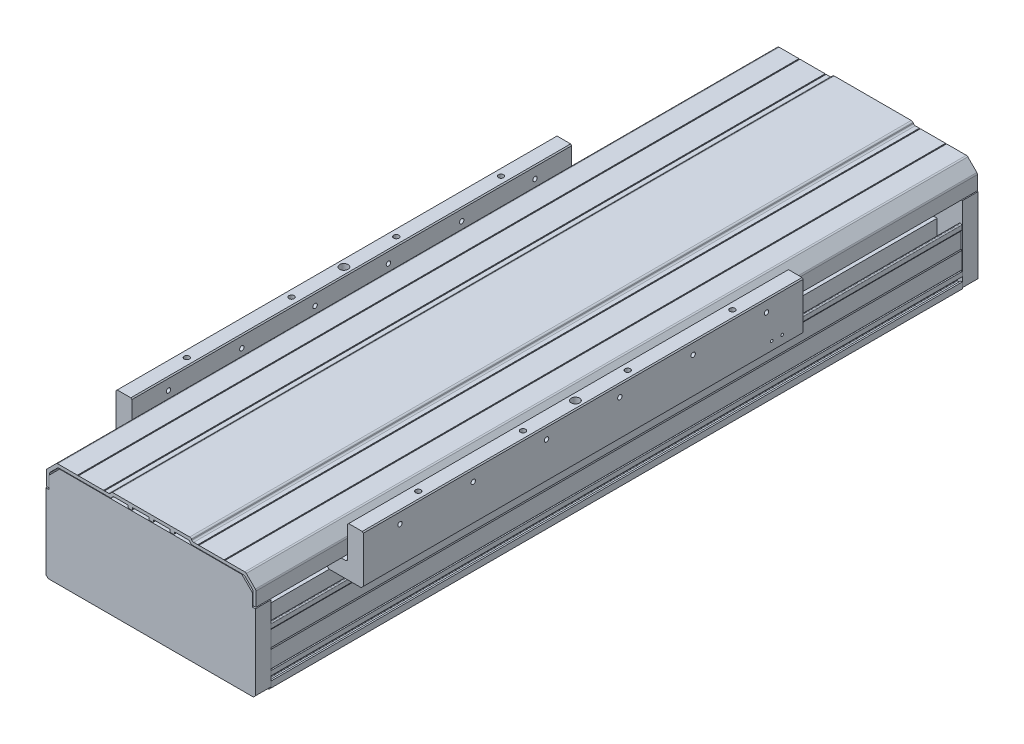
SolidWorks part; units mm, degrees
ref_plane "정면" through (0, 0, 0) normal (0, 0, 1) x (1, 0, 0)
ref_plane "윗면" through (0, 0, 0) normal (0, 1, 0) x (1, 0, 0)
ref_plane "우측면" through (0, 0, 0) normal (1, 0, 0) x (0, 0, -1)
sketch "스케치1" plane through (0, 0, 0) normal (0, 0, 1) x (1, 0, 0)
  line L0 (-99, 33.5) -> (-99, 48.5)
  line L1 (-97, 16.5) -> (-97, 53.5)
  line L2 (-99.5, 16.5) -> (-99.5, 32.5)
  line L3 (-97.5, 16) -> (-99, 16)
  line L4 (-99, 33.5) -> (-99.5, 32.5)
  line L5 (-98.5, 54.5) -> (-98, 54.5)
  line L6 (-99.5, 49.5) -> (-99.5, 53.5)
  line L7 (-99, 48.5) -> (-99.5, 49.5)
  line L8 (99, 33.5) -> (99, 48.5)
  line L9 (97, 16.5) -> (97, 53.5)
  line L10 (99.5, 16.5) -> (99.5, 32.5)
  line L11 (97.5, 16) -> (99, 16)
  line L12 (99, 33.5) -> (99.5, 32.5)
  line L13 (98.5, 54.5) -> (98, 54.5)
  line L14 (99.5, 49.5) -> (99.5, 53.5)
  line L15 (99, 48.5) -> (99.5, 49.5)
  line L16 (-78, 44.5) -> (-43.5, 44.5)
  line L17 (-36, -1) -> (-98, -1)
  line L18 (-66.55, 32.5) -> (-54.5, 32.5)
  line L19 (-100, 1) -> (-98, -1)
  line L20 (-78, 44.5) -> (-78, 37.5)
  line L21 (-69.5, 14.5) -> (-69.5, 30.0927)
  line L22 (-77.7, 37) -> (-78, 36.5)
  line L23 (-78, 37.5) -> (-77.7, 37)
  line L24 (-78, 26.5) -> (-77.1807, 25.0809)
  line L25 (-78, 36.5) -> (-78, 26.5)
  line L26 (-97, 21) -> (-97, 15.5)
  line L27 (-97, 25.5) -> (-97, 22)
  line L28 (-97, 15.5) -> (-100, 15.5)
  line L29 (36, -1) -> (98, -1)
  line L30 (35, 0) -> (-35, 0)
  line L31 (-35, 0) -> (-36, -1)
  line L32 (36, -1) -> (35, 0)
  line L33 (100, 1) -> (98, -1)
  line L34 (-16.9019, 9.5) -> (-14.3038, 11)
  line L35 (-14.3038, 5) -> (-16.9019, 6.5)
  line L36 (-22.5, 16) -> (22.5, 16)
  line L37 (-23, 16.5) -> (-22.5, 16)
  line L38 (-16.9019, 9.5) -> (-18.0629, 9.5)
  line L39 (-16.9019, 6.5) -> (-18.0629, 6.5)
  line L40 (-52.5, 30.5) -> (-52.5, 16.25)
  line L41 (-52, 15.75) -> (-51.4079, 15.75)
  line L42 (-51.6685, 12.5) -> (-67.5, 12.5)
  line L43 (-38.5, 16.5) -> (-23, 16.5)
  line L44 (22.5, 16) -> (23, 16.5)
  line L45 (23, 16.5) -> (38.5, 16.5)
  line L46 (16.9019, 9.5) -> (14.3038, 11)
  line L47 (14.3038, 5) -> (16.9019, 6.5)
  line L48 (16.9019, 9.5) -> (18.0629, 9.5)
  line L49 (16.9019, 6.5) -> (18.0629, 6.5)
  line L50 (-4, 9) -> (4, 9)
  line L51 (-7.3333, 11) -> (-4, 9)
  line L52 (7.3333, 11) -> (4, 9)
  line L53 (-14.3038, 11) -> (-7.3333, 11)
  line L54 (-14.3038, 5) -> (14.3038, 5)
  line L55 (7.3333, 11) -> (14.3038, 11)
  line L56 (43.5, 22.5) -> (43.5, 44.5)
  line L57 (97, 21) -> (97, 15.5)
  line L58 (97, 15.5) -> (100, 15.5)
  line L59 (97, 25.5) -> (97, 22)
  line L60 (95, 25.5) -> (97, 25.5)
  line L61 (95, 24) -> (95, 25.5)
  line L62 (71, 47.5) -> (71, 44.5)
  line L63 (71, 47.5) -> (76, 47.5)
  line L64 (71, 44.5) -> (43.5, 44.5)
  line L65 (100, 1) -> (100, 6.85)
  line L66 (98.5, 11.15) -> (100, 11.15)
  line L67 (98.5, 12.65) -> (98.5, 11.15)
  line L68 (95.5, 12.65) -> (98.5, 12.65)
  line L69 (95, 5.85) -> (95, 12.15)
  line L70 (98.5, 5.35) -> (95.5, 5.35)
  line L71 (98.5, 6.85) -> (98.5, 5.35)
  line L72 (100, 6.85) -> (98.5, 6.85)
  line L73 (100, 11.15) -> (100, 15.5)
  line L74 (-100, 1) -> (-100, 6.85)
  line L75 (-98.5, 11.15) -> (-100, 11.15)
  line L76 (-98.5, 12.65) -> (-98.5, 11.15)
  line L77 (-95.5, 12.65) -> (-98.5, 12.65)
  line L78 (-95, 5.85) -> (-95, 12.15)
  line L79 (-98.5, 5.35) -> (-95.5, 5.35)
  line L80 (-98.5, 6.85) -> (-98.5, 5.35)
  line L81 (-100, 6.85) -> (-98.5, 6.85)
  line L82 (-100, 11.15) -> (-100, 15.5)
  line L83 (38.5, 17.5) -> (38.5, 16.5)
  line L84 (-43.5, 22.5) -> (-43.5, 44.5)
  line L85 (-38.5, 17.5) -> (-38.5, 16.5)
  line L86 (80.8, 21) -> (79.5, 21)
  line L87 (79.5, 18) -> (93.5, 18)
  line L88 (79.5, 21) -> (79.5, 18)
  line L89 (92, 21.2) -> (92, 22.8)
  line L90 (92.2, 21) -> (92, 21.2)
  line L91 (93.5, 21) -> (92.2, 21)
  line L92 (92.2, 23) -> (94, 23)
  line L93 (92, 22.8) -> (92.2, 23)
  line L94 (93.5, 18) -> (93.5, 21)
  line L95 (81, 22.8) -> (81, 21.2)
  line L96 (81, 21.2) -> (80.8, 21)
  line L97 (80.8, 23) -> (81, 22.8)
  line L98 (78.4, 23) -> (80.8, 23)
  line L99 (-95, 25.5) -> (-97, 25.5)
  line L100 (-95, 24) -> (-95, 25.5)
  line L101 (-80.8, 21) -> (-79.5, 21)
  line L102 (-79.5, 18) -> (-93.5, 18)
  line L103 (-79.5, 21) -> (-79.5, 18)
  line L104 (-92, 21.2) -> (-92, 22.8)
  line L105 (-92.2, 21) -> (-92, 21.2)
  line L106 (-93.5, 21) -> (-92.2, 21)
  line L107 (-92.2, 23) -> (-94, 23)
  line L108 (-92, 22.8) -> (-92.2, 23)
  line L109 (-93.5, 18) -> (-93.5, 21)
  line L110 (-81, 22.8) -> (-81, 21.2)
  line L111 (-81, 21.2) -> (-80.8, 21)
  line L112 (-80.8, 23) -> (-81, 22.8)
  line L113 (-78.4, 23) -> (-80.8, 23)
  line L114 (76, 47.5) -> (76, 31.4999)
  line L115 (76, 31.4999) -> (76.3, 31.4999)
  line L116 (76.3, 31.4999) -> (76.3, 24.581)
  line L117 (-97, 22) -> (-96.7, 21.5)
  line L118 (-96.7, 21.5) -> (-97, 21)
  line L119 (97, 22) -> (96.7, 21.5)
  line L120 (96.7, 21.5) -> (97, 21)
  line L121 (66.55, 32.5) -> (54.5, 32.5)
  line L122 (69.5, 14.5) -> (69.5, 30.0927)
  line L123 (52.5, 30.5) -> (52.5, 16.25)
  line L124 (52, 15.75) -> (51.4079, 15.75)
  line L125 (51.6685, 12.5) -> (67.5, 12.5)
  arc A0 (-99.5, 16.5) -> (-99, 16) centre (-99, 16.5) ccw
  arc A1 (-97.5, 16) -> (-97, 16.5) centre (-97.5, 16.5) ccw
  arc A2 (-98.5, 54.5) -> (-99.5, 53.5) centre (-98.5, 53.5) ccw
  arc A3 (-97, 53.5) -> (-98, 54.5) centre (-98, 53.5) ccw
  arc A4 (99, 16) -> (99.5, 16.5) centre (99, 16.5) ccw
  arc A5 (97, 16.5) -> (97.5, 16) centre (97.5, 16.5) ccw
  arc A6 (99.5, 53.5) -> (98.5, 54.5) centre (98.5, 53.5) ccw
  arc A7 (98, 54.5) -> (97, 53.5) centre (98, 53.5) ccw
  arc A8 (-69.5, 14.5) -> (-67.5, 12.5) centre (-67.5, 14.5) ccw
  arc A9 (-77.4769, 22.3846) -> (-76.1936, 24.5882) centre (-76, 23) ccw
  arc A10 (-77.4769, 22.3846) -> (-78.4, 23) centre (-78.4, 22) ccw
  arc A11 (-67.05, 33) -> (-66.55, 32.5) centre (-66.55, 33) ccw
  arc A12 (-77.1807, 25.0809) -> (-76.1936, 24.5882) centre (-76.3147, 25.5809) ccw
  arc A13 (-69.5, 30.0927) -> (-69.9153, 30.5854) centre (-70, 30.0927) ccw
  arc A14 (-18.0629, 9.5) -> (-18.0629, 6.5) centre (-20, 8) ccw
  arc A15 (-52.5, 16.25) -> (-52, 15.75) centre (-52, 16.25) ccw
  arc A16 (-51.4079, 15.75) -> (-51.0845, 15.8686) centre (-51.4079, 16.25) ccw
  arc A17 (-51.301, 12.339) -> (-51.0845, 15.8686) centre (-49.5, 14) ccw
  arc A18 (-51.301, 12.339) -> (-51.6685, 12.5) centre (-51.6685, 12) ccw
  arc A19 (-52.5, 30.5) -> (-54.5, 32.5) centre (-54.5, 30.5) ccw
  arc A20 (18.0629, 6.5) -> (18.0629, 9.5) centre (20, 8) ccw
  arc A21 (38.5, 17.5) -> (43.5, 22.5) centre (38.5, 22.5) ccw
  arc A22 (78.4, 23) -> (77.4769, 22.3846) centre (78.4, 22) ccw
  arc A23 (94, 23) -> (95, 24) centre (94, 24) ccw
  arc A24 (95.5, 12.65) -> (95, 12.15) centre (95.5, 12.15) ccw
  arc A25 (95, 5.85) -> (95.5, 5.35) centre (95.5, 5.85) ccw
  arc A26 (-95, 12.15) -> (-95.5, 12.65) centre (-95.5, 12.15) ccw
  arc A27 (-95.5, 5.35) -> (-95, 5.85) centre (-95.5, 5.85) ccw
  arc A28 (-43.5, 22.5) -> (-38.5, 17.5) centre (-38.5, 22.5) ccw
  arc A29 (-67.05, 33) -> (-69.9153, 30.5854) centre (-69.5, 33) ccw
  arc A30 (-95, 24) -> (-94, 23) centre (-94, 24) ccw
  arc A31 (76.1936, 24.5882) -> (77.4769, 22.3846) centre (76, 23) ccw
  arc A32 (76.1936, 24.5882) -> (76.3, 24.581) centre (76.3147, 25.5809) ccw
  arc A33 (67.5, 12.5) -> (69.5, 14.5) centre (67.5, 14.5) ccw
  arc A34 (66.55, 32.5) -> (67.05, 33) centre (66.55, 33) ccw
  arc A35 (69.9153, 30.5854) -> (69.5, 30.0927) centre (70, 30.0927) ccw
  arc A36 (52, 15.75) -> (52.5, 16.25) centre (52, 16.25) ccw
  arc A37 (51.0845, 15.8686) -> (51.4079, 15.75) centre (51.4079, 16.25) ccw
  arc A38 (51.0845, 15.8686) -> (51.301, 12.339) centre (49.5, 14) ccw
  arc A39 (51.6685, 12.5) -> (51.301, 12.339) centre (51.6685, 12) ccw
  arc A40 (54.5, 32.5) -> (52.5, 30.5) centre (54.5, 30.5) ccw
  arc A41 (69.9153, 30.5854) -> (67.05, 33) centre (69.5, 33) ccw
extrude "보스-돌출1" add sketch "스케치1" along normal mid plane 660 contours A31 A32 L116 L115 L114 L63 L62 L64 L56 A21 L83 L45 L44 L36 L37 L43 L85 A28 L84 L16 L20 L23 L22 L25 L24 A12 A9 A10 L113 L112 L110 L111 L101 L103 L102 L109 L106 L105 L104 L108 L107 A30 L100 L99 L1 L117 L118 L26 L28 L82 | L9 A7 L13 A6 L14 L15 L8 L12 L10 A4 L11 A5
sketch "스케치2" plane through (0, 0, 330) normal (0, 0, 1) x (1, 0, 0)
  line L0 (97, 86) -> (87, 96)
  line L1 (-98, 0) -> (98, 0)
  line L2 (-87, 96) -> (87, 96)
  line L3 (-100, 74) -> (-100, 2)
  line L4 (-100, 2) -> (-98, 0)
  line L5 (-97, 86) -> (-87, 96)
  line L6 (-97, 86) -> (-97, 74)
  line L7 (-100, 74) -> (-97, 74)
  line L8 (100, 74) -> (100, 2)
  line L9 (100, 2) -> (98, 0)
  line L10 (97, 86) -> (97, 74)
  line L11 (97, 74) -> (100, 74)
extrude "보스-돌출2" add sketch "스케치2" along normal blind 15 separate body
sketch "스케치3" plane through (0, 0, -330) normal (0, 0, -1) x (-1, 0, 0)
  line L0 (97, 86) -> (87, 96)
  line L1 (-98, 0) -> (98, 0)
  line L2 (-87, 96) -> (87, 96)
  line L3 (-100, 74) -> (-100, 2)
  line L4 (-100, 2) -> (-98, 0)
  line L5 (-97, 86) -> (-87, 96)
  line L6 (-97, 86) -> (-97, 74)
  line L7 (-100, 74) -> (-97, 74)
  line L8 (100, 74) -> (100, 2)
  line L9 (100, 2) -> (98, 0)
  line L10 (97, 86) -> (97, 74)
  line L11 (97, 74) -> (100, 74)
extrude "보스-돌출3" add sketch "스케치3" along normal blind 15 separate body
ref_plane "평면1" through (0, 0, 260) normal (0, 0, 1) x (1, 0, 0)
sketch "스케치4" plane through (0, 0, 260) normal (0, 0, 1) x (1, 0, 0)
  line L0 (0, 0) -> (0, 72.5) construction
  line L1 (35, 0) -> (-35, 0) construction
  line L2 (104, 104) -> (103, 103)
  line L3 (103, 103) -> (103, 74)
  line L4 (101, 72) -> (96, 72)
  line L5 (94, 74) -> (94, 77.5)
  line L6 (84, 87.5) -> (58.5, 87.5)
  line L7 (58.5, 87.5) -> (56.5, 89.5)
  line L8 (56.5, 89.5) -> (-56.5, 89.5)
  line L9 (-56.5, 89.5) -> (-58.5, 87.5)
  line L10 (-58.5, 87.5) -> (-84, 87.5)
  line L11 (-94, 77.5) -> (-94, 74)
  line L12 (-96, 72) -> (-101, 72)
  line L13 (-103, 74) -> (-103, 103)
  line L14 (-103, 103) -> (-104, 104)
  line L15 (83, 72.5) -> (-83, 72.5)
  line L16 (-118, 59) -> (-118, 103)
  line L17 (-118, 59) -> (-118, 103)
  line L18 (-116, 57) -> (-85, 57)
  line L19 (-118, 59) -> (-116, 57)
  line L20 (-85, 57) -> (-83, 59)
  line L21 (-83, 59) -> (-83, 72.5)
  line L22 (-117, 104) -> (-104, 104)
  line L23 (-117, 104) -> (-118, 103)
  line L26 (83, 72.5) -> (83, 59)
  line L27 (84, 87.5) -> (58.5, 87.5)
  line L28 (118, 59) -> (118, 103)
  line L29 (85, 57) -> (116, 57)
  line L30 (116, 57) -> (118, 59)
  line L31 (117, 104) -> (104, 104)
  line L32 (118, 103) -> (117, 104)
  line L33 (81.75, 87.5) -> (84, 87.5)
  line L34 (83, 59) -> (85, 57)
  arc A0 (101, 72) -> (103, 74) centre (101, 74) ccw
  arc A1 (94, 74) -> (96, 72) centre (96, 74) ccw
  arc A2 (94, 77.5) -> (84, 87.5) centre (84, 77.5) ccw
  arc A3 (-84, 87.5) -> (-94, 77.5) centre (-84, 77.5) ccw
  arc A4 (-96, 72) -> (-94, 74) centre (-96, 74) ccw
  arc A5 (-103, 74) -> (-101, 72) centre (-101, 74) ccw
  dimension "D1" = 72.5
extrude "보스-돌출4" add sketch "스케치4" against normal blind 420 separate body contours A5 L13 L14 L22 L23 L16 L19 L18 L20 L21 L15 L26 L34 L29 L30 L28 L32 L31 L2 L3 A0 L4 A1 L5 A2 L6 L27 L7 L8 L9 L10 A3 L11 A4 L12
sketch "스케치5" plane through (0, 0, 0) normal (0, 0, 1) x (1, 0, 0)
  line L0 (0, 0) -> (0, 101.5) construction
  line L1 (-98, 0) -> (98, 0) construction
  line L2 (36.7494, 101.5) -> (-36.7494, 101.5)
  line L3 (-45.5, 99) -> (-69.5, 99)
  line L4 (-88.1265, 96) -> (-39.2151, 96)
  line L5 (-90.7833, 98.4142) -> (-99.4142, 89.7833)
  line L6 (-96.4142, 88.5407) -> (-89.5407, 95.4142)
  line L7 (-100, 75) -> (-97, 75)
  line L8 (-97, 75) -> (-97, 87.1265)
  line L9 (-100, 88.3691) -> (-100, 75)
  line L10 (-70.5, 99) -> (-89.3691, 99)
  line L11 (-70, 98.7) -> (-70.5, 99)
  line L12 (-69.5, 99) -> (-70, 98.7)
  line L13 (-37.518, 96.9417) -> (-37.1335, 97.5583)
  line L14 (-40.528, 99) -> (-44.5, 99)
  line L15 (-45, 98.7) -> (-45.5, 99)
  line L16 (-44.5, 99) -> (-45, 98.7)
  line L17 (-38.4465, 100.5583) -> (-38.831, 99.9417)
  line L18 (2.25, 98.5) -> (17.75, 98.5)
  line L19 (-18, 96.75) -> (-18, 98.25)
  line L20 (-22, 98.25) -> (-22, 96.75)
  line L21 (-21.25, 96) -> (-18.75, 96)
  line L22 (2, 96.75) -> (2, 98.25)
  line L23 (-1.25, 96) -> (1.25, 96)
  line L24 (-2, 98.25) -> (-2, 96.75)
  line L25 (-17.75, 98.5) -> (-2.25, 98.5)
  line L26 (-35.4364, 98.5) -> (-22.25, 98.5)
  line L27 (22, 96.75) -> (22, 98.25)
  line L28 (18.75, 96) -> (21.25, 96)
  line L29 (18, 98.25) -> (18, 96.75)
  line L30 (22.25, 98.5) -> (35.4364, 98.5)
  line L31 (89.3691, 99) -> (70.5, 99)
  line L32 (39.2151, 96) -> (88.1265, 96)
  line L33 (37.1335, 97.5583) -> (37.518, 96.9417)
  line L34 (69.5, 99) -> (45.5, 99)
  line L35 (38.831, 99.9417) -> (38.4465, 100.5583)
  line L36 (44.5, 99) -> (40.528, 99)
  line L37 (45, 98.7) -> (44.5, 99)
  line L38 (45.5, 99) -> (45, 98.7)
  line L39 (70, 98.7) -> (69.5, 99)
  line L40 (70.5, 99) -> (70, 98.7)
  line L41 (99.4142, 89.7833) -> (90.7833, 98.4142)
  line L42 (97, 75) -> (100, 75)
  line L43 (89.5407, 95.4142) -> (96.4142, 88.5407)
  line L44 (97, 87.1265) -> (97, 75)
  line L45 (100, 75) -> (100, 88.3691)
  arc A0 (-88.1265, 96) -> (-89.5407, 95.4142) centre (-88.1265, 94) ccw
  arc A1 (-96.4142, 88.5407) -> (-97, 87.1265) centre (-95, 87.1265) ccw
  arc A2 (-99.4142, 89.7833) -> (-100, 88.3691) centre (-98, 88.3691) ccw
  arc A3 (-89.3691, 99) -> (-90.7833, 98.4142) centre (-89.3691, 97) ccw
  arc A4 (-35.4364, 98.5) -> (-37.1335, 97.5583) centre (-35.4364, 96.5) ccw
  arc A5 (-39.2151, 96) -> (-37.518, 96.9417) centre (-39.2151, 98) ccw
  arc A6 (-36.7494, 101.5) -> (-38.4465, 100.5583) centre (-36.7494, 99.5) ccw
  arc A7 (-40.528, 99) -> (-38.831, 99.9417) centre (-40.528, 101) ccw
  arc A8 (2.25, 98.5) -> (2, 98.25) centre (2.25, 98.25) ccw
  arc A9 (-2, 98.25) -> (-2.25, 98.5) centre (-2.25, 98.25) ccw
  arc A10 (-17.75, 98.5) -> (-18, 98.25) centre (-17.75, 98.25) ccw
  arc A11 (-22, 98.25) -> (-22.25, 98.5) centre (-22.25, 98.25) ccw
  arc A12 (-18.75, 96) -> (-18, 96.75) centre (-18.75, 96.75) ccw
  arc A13 (-22, 96.75) -> (-21.25, 96) centre (-21.25, 96.75) ccw
  arc A14 (1.25, 96) -> (2, 96.75) centre (1.25, 96.75) ccw
  arc A15 (-2, 96.75) -> (-1.25, 96) centre (-1.25, 96.75) ccw
  arc A16 (22.25, 98.5) -> (22, 98.25) centre (22.25, 98.25) ccw
  arc A17 (18, 98.25) -> (17.75, 98.5) centre (17.75, 98.25) ccw
  arc A18 (21.25, 96) -> (22, 96.75) centre (21.25, 96.75) ccw
  arc A19 (18, 96.75) -> (18.75, 96) centre (18.75, 96.75) ccw
  arc A20 (37.1335, 97.5583) -> (35.4364, 98.5) centre (35.4364, 96.5) ccw
  arc A21 (37.518, 96.9417) -> (39.2151, 96) centre (39.2151, 98) ccw
  arc A22 (38.4465, 100.5583) -> (36.7494, 101.5) centre (36.7494, 99.5) ccw
  arc A23 (38.831, 99.9417) -> (40.528, 99) centre (40.528, 101) ccw
  arc A24 (89.5407, 95.4142) -> (88.1265, 96) centre (88.1265, 94) ccw
  arc A25 (97, 87.1265) -> (96.4142, 88.5407) centre (95, 87.1265) ccw
  arc A26 (100, 88.3691) -> (99.4142, 89.7833) centre (98, 88.3691) ccw
  arc A27 (90.7833, 98.4142) -> (89.3691, 99) centre (89.3691, 97) ccw
  dimension "D1" = 101.5
extrude "보스-돌출5" add sketch "스케치5" along normal mid plane 689 separate body
hole_wizard "M8 육각 머리 볼트용 카운터보어1" positions "스케치8" profile "스케치7" counterbore size "M8" standard "ISO"
sketch "스케치8" plane through (0, 18, 0) normal (0, 1, 0) x (-1, 0, 0)
  line L0 (-35, 330) -> (35, 330) construction
  line L1 (-36, 330) -> (-98, 330) construction
  point P0 (86.5, 240)
  point P1 (-86.5, 240)
  point P8 (0, 330)
  dimension "D1" = 173
  dimension "D2" = 86.5
  dimension "D3" = 90
sketch "스케치7" plane through (-86.5, 18, 240) normal (1, 0, 0) x (0, 0, 1)
  line L0 (0, 0) -> (0, 19)
  line L1 (0, 19) -> (4.5, 19)
  line L3 (4.5, 19) -> (4.5, 9)
  line L4 (4.5, 9) -> (7, 9)
  line L5 (7, 9) -> (7, 0)
  line L7 (7, 0) -> (0, 0)
  line L11 (0, -6.35) -> (0, 107.95) construction
  dimension "관통 구멍 지름" = 9
  dimension "관통 구멍 깊이" = 19
  dimension "카운터보어 지름" = 14
  dimension "카운터보어 깊이" = 9
pattern_linear "선형 패턴1" count 3 spacing 240 along (0, 0, -1) of "M8 육각 머리 볼트용 카운터보어1"
hole_wizard "M6 나사 구멍1" positions "스케치10" profile "스케치9" tap size "M6" standard "ISO"
sketch "스케치10" plane through (0, 104, 0) normal (0, 1, 0) x (-1, 0, 0)
  line L0 (-117, 260) -> (-104, 260) construction
  line L1 (-118, -160) -> (-118, 260) construction
  point P0 (-110.5, 200)
  point P1 (-110.5, 100)
  point P3 (-110.5, 0)
  point P5 (-110.5, -100)
  dimension "D1" = 60
  dimension "D2" = 100
  dimension "D3" = 100
  dimension "D4" = 100
  dimension "D5" = 7.5
sketch "스케치9" plane through (110.5, 104, 200) normal (1, 0, 0) x (0, 0, 1)
  line L0 (0, 0) -> (0, 24.5022)
  line L1 (0, 24.5022) -> (2.5, 23)
  line L2 (2.5, 23) -> (2.5, 0)
  line L5 (2.5, 0) -> (0, 0)
  line L10 (0, 24.5022) -> (-2.5, 23) construction
  line L11 (0, -6.35) -> (0, 107.95) construction
  dimension "탭 드릴 지름" = 5
  dimension "탭 드릴 깊이" = 23
  dimension "드릴 각도" = 118
hole_wizard "M5 나사 구멍1" positions "스케치12" profile "스케치11" tap size "M5" standard "ISO"
sketch "스케치12" plane through (118, 0, 0) normal (1, 0, 0) x (0, 0, -1)
  line L0 (160, 59) -> (160, 103) construction
  line L1 (160, 104) -> (-260, 104) construction
  point P0 (-225, 93)
  point P1 (-155, 93)
  point P3 (-15, 93)
  point P5 (125, 93)
  point P15 (55, 93)
  point P17 (-85, 93)
  dimension "D1" = 35
  dimension "D2" = 70
  dimension "D3" = 70
  dimension "D4" = 70
  dimension "D5" = 70
  dimension "D6" = 70
  dimension "D7" = 11
sketch "스케치11" plane through (118, 93, 225) normal (0, 1, 0) x (0, 0, -1)
  line L0 (0, 0) -> (0, 17.2618)
  line L1 (0, 17.2618) -> (2.1, 16)
  line L2 (2.1, 16) -> (2.1, 0)
  line L5 (2.1, 0) -> (0, 0)
  line L10 (0, 17.2618) -> (-2.1, 16) construction
  line L11 (0, -6.35) -> (0, 107.95) construction
  dimension "탭 드릴 지름" = 4.2
  dimension "탭 드릴 깊이" = 16
  dimension "드릴 각도" = 118
sketch "스케치13" plane through (0, 104, 0) normal (0, 1, 0) x (1, 0, 0)
  line L0 (118, 160) -> (118, -260) construction
  line L1 (117, 160) -> (104, 160) construction
  circle A0 centre (110.5, -50) radius 2.5
  dimension "D1" = 5
  dimension "D2" = 7.5
  dimension "D3" = 210
extrude "컷-돌출1" cut sketch "스케치13" against normal up to next (47 mm away)
sketch "스케치14" plane through (0, 104, 0) normal (0, 1, 0) x (1, 0, 0)
  circle A0 centre (110.5, -50) radius 4
  dimension "D1" = 8
extrude "컷-돌출2" cut sketch "스케치14" against normal blind 18
mirror "대칭 복사1" about plane through (0, 0, 0) normal (1, 0, 0) of "컷-돌출2", "컷-돌출1", "M5 나사 구멍1", "M6 나사 구멍1"
hole_wizard "M3 나사 구멍1" positions "스케치16" profile "스케치15" tap size "M3" standard "ISO"
sketch "스케치16" plane through (118, 0, 0) normal (1, 0, 0) x (0, 0, -1)
  line L0 (160, 59) -> (160, 103) construction
  line L1 (160, 57) -> (-260, 57) construction
  point P0 (140, 67)
  point P1 (130, 67)
  dimension "D1" = 20
  dimension "D2" = 10
  dimension "D3" = 10
sketch "스케치15" plane through (118, 67, -140) normal (0, 1, 0) x (0, 0, -1)
  line L0 (0, 0) -> (0, 13.2511)
  line L1 (0, 13.2511) -> (1.25, 12.5)
  line L2 (1.25, 12.5) -> (1.25, 0)
  line L5 (1.25, 0) -> (0, 0)
  line L10 (0, 13.2511) -> (-1.25, 12.5) construction
  line L11 (0, -6.35) -> (0, 107.95) construction
  dimension "탭 드릴 지름" = 2.5
  dimension "탭 드릴 깊이" = 12.5
  dimension "드릴 각도" = 118
mirror "대칭 복사2" about plane through (0, 0, 0) normal (1, 0, 0) of "M3 나사 구멍1"
